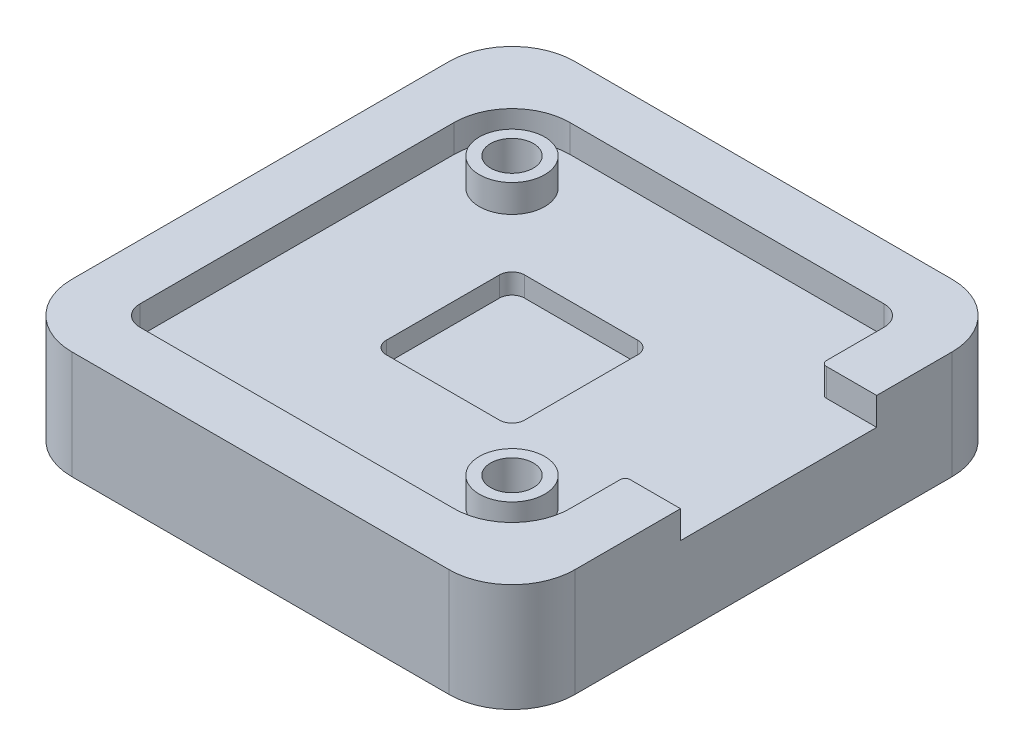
SolidWorks part; units mm, degrees
ref_plane "Front" through (0, 0, 0) normal (0, 0, 1) x (1, 0, 0)
ref_plane "Top" through (0, 0, 0) normal (0, 1, 0) x (1, 0, 0)
ref_plane "Right" through (0, 0, 0) normal (1, 0, 0) x (0, 0, -1)
sketch "Sketch1" plane through (0, 0, 0) normal (0, 1, 0) x (1, 0, 0)
  line L1 (-7.5, -10) -> (7.5, -10)
  line L2 (-10, -7.5) -> (-10, 7.5)
  line L3 (-7.5, 10) -> (7.5, 10)
  line L4 (10, -7.5) -> (10, 7.5)
  line L5 (-10, -10) -> (10, 10) construction
  line L6 (-10, 10) -> (10, -10) construction
  arc A0 (10, 7.5) -> (7.5, 10) centre (7.5, 7.5) ccw
  arc A1 (10, -7.5) -> (7.5, -10) centre (7.5, -7.5) cw
  arc A2 (-7.5, -10) -> (-10, -7.5) centre (-7.5, -7.5) cw
  arc A3 (-10, 7.5) -> (-7.5, 10) centre (-7.5, 7.5) cw
  point P0 (0, 0)
  dimension "D3" = 2.5
  dimension "D1" = 20
  dimension "D2" = 20
extrude "Boss-Extrude1" add sketch "Sketch1" along normal blind 4.3
sketch "Sketch2" plane through (0, 4.3, 0) normal (0, 1, 0) x (1, 0, 0)
  line L0 (7, 7.8) -> (-5.5, 7.8)
  line L5 (-7.8, -7) -> (-7.8, 5.5)
  line L6 (-7, -7.8) -> (5.5, -7.8)
  line L7 (7.8, -5.5) -> (7.8, 7)
  line L8 (-7.8, -7.8) -> (7.8, 7.8) construction
  line L11 (-7.5, -7.5) -> (5.5, -7.5) construction
  line L12 (-7.5, -7.5) -> (-7.5, 5.5) construction
  line L13 (-5.5, 7.5) -> (7.5, 7.5) construction
  line L14 (7.5, -5.5) -> (7.5, 7.5) construction
  line L15 (-7.5, -7.5) -> (7.5, 7.5) construction
  line L16 (-7.5, 7.5) -> (7.5, -7.5) construction
  arc A4 (7.5, -5.5) -> (5.5, -7.5) centre (5.5, -5.5) cw construction
  arc A5 (-5.5, 7.5) -> (-7.5, 5.5) centre (-5.5, 5.5) ccw construction
  circle A6 centre (-5.5, 5.5) radius 1.3
  circle A7 centre (5.5, -5.5) radius 1.3
  arc A21 (-7, -7.8) -> (-7.8, -7) centre (-7, -7) cw
  arc A22 (7, 7.8) -> (7.8, 7) centre (7, 7) cw
  arc A23 (-5.5, 7.8) -> (-7.8, 5.5) centre (-5.5, 5.5) ccw
  arc A24 (7.8, -5.5) -> (5.5, -7.8) centre (5.5, -5.5) cw
  point P0 (0, 0)
  point P10 (0, 0)
  point P13 (0, 0)
  dimension "D3" = 15.6
  dimension "D4" = 0.8
  dimension "D7" = 2
  dimension "D8" = 2.6
  dimension "D9" = 15.6
  dimension "D2" = 2.3
  dimension "D5" = 15
  dimension "D6" = 15
extrude "Cut-Extrude1" cut sketch "Sketch2" against normal blind 1.1
sketch "Sketch5" plane through (10, 0, 0) normal (1, 0, 0) x (0, 0, -1)
  line L11 (0.6, 3.2) -> (0.6, 6.2) construction
  line L12 (10, 4.3) -> (10, 0) construction
  line L13 (-4.2, 3.2) -> (-6.8, 3.2) construction
  line L23 (-3.3, 6.2) -> (-3.3, 3.2)
  line L24 (-3.3, 3.2) -> (4.5, 3.2)
  line L25 (4.5, 3.2) -> (4.5, 6.2)
  line L26 (4.5, 6.2) -> (-3.3, 6.2)
  dimension "D1" = 9.4
  dimension "D3" = 7.8
  dimension "D4" = 3
extrude "Cut-Extrude3" cut sketch "Sketch5" against normal up to surface (2.2 mm away)
hole_wizard "CBORE for M1.6 Hex Socket Head Cap Screw1" positions "Sketch6" profile "Sketch7" counterbore size "M1.6" standard "DIN"
sketch "Sketch6" plane through (0, 0, 0) normal (0, -1, 0) x (-1, 0, 0)
  point P8 (-5.5, -5.5)
  point P15 (5.5, 5.5)
sketch "Sketch7" plane through (5.5, 0, 5.5) normal (1, 0, 0) x (0, 0, -1)
  line L0 (0, 0) -> (0, 4.3)
  line L1 (0, 4.3) -> (0.85, 4.3)
  line L3 (0.85, 4.3) -> (0.85, 2)
  line L4 (0.85, 2) -> (1.75, 2)
  line L5 (1.75, 2) -> (1.75, 0)
  line L7 (1.75, 0) -> (0, 0)
  line L11 (0, -6.35) -> (0, 107.95) construction
  dimension "Thru Hole Dia." = 1.7
  dimension "Thru Hole Depth" = 4.3
  dimension "C'Bore Dia." = 3.5
  dimension "C'Bore Depth" = 2
fillet "Fillet1" radius 0.2 2 edges at (7.8, 3.75, -4.5) (7.8, 3.75, 3.3)
sketch "Sketch8" plane through (0, 3.2, 0) normal (0, 1, 0) x (1, 0, 0)
  line L15 (2.25, -2.75) -> (-2.25, -2.75)
  line L16 (2.75, -2.25) -> (2.75, 2.25)
  line L17 (2.25, 2.75) -> (-2.25, 2.75)
  line L18 (-2.75, -2.25) -> (-2.75, 2.25)
  line L19 (2.75, -2.75) -> (-2.75, 2.75) construction
  line L20 (2.75, 2.75) -> (-2.75, -2.75) construction
  arc A12 (-2.25, 2.75) -> (-2.75, 2.25) centre (-2.25, 2.25) ccw
  arc A13 (2.25, 2.75) -> (2.75, 2.25) centre (2.25, 2.25) cw
  arc A14 (2.75, -2.25) -> (2.25, -2.75) centre (2.25, -2.25) cw
  arc A15 (-2.25, -2.75) -> (-2.75, -2.25) centre (-2.25, -2.25) cw
  point P0 (0, 0)
  point P42 (0, 0)
  dimension "D8" = 0.5
  dimension "D6" = 5.5
  dimension "D7" = 5.5
extrude "Cut-Extrude4" cut sketch "Sketch8" against normal blind 0.8
